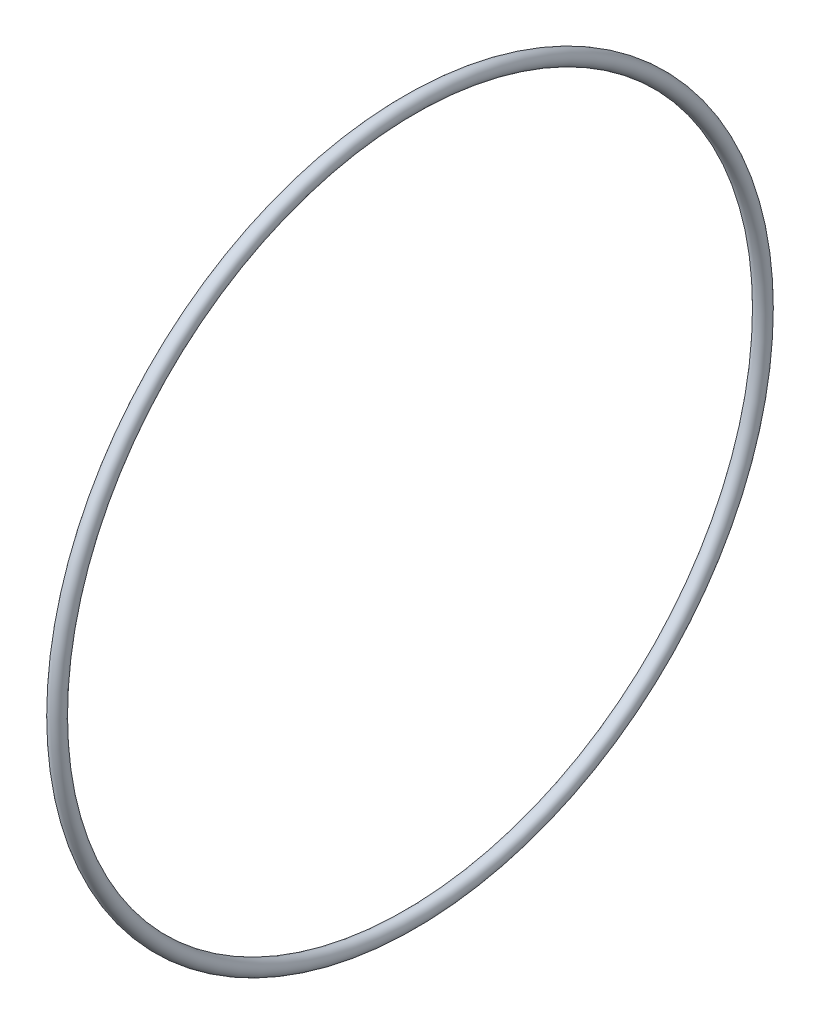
SolidWorks part; units mm, degrees
ref_plane "Plan de face" through (0, 0, 0) normal (0, 0, 1) x (1, 0, 0)
ref_plane "Plan de dessus" through (0, 0, 0) normal (0, 1, 0) x (1, 0, 0)
ref_plane "Plan de droite" through (0, 0, 0) normal (1, 0, 0) x (0, 0, -1)
sketch "Esquisse1" plane through (0, 0, 0) normal (0, 0, 1) x (1, 0, 0)
  line L0 (0, 0) -> (-49.5434, 0) construction
  circle A0 centre (0, 16.75) radius 0.35
  dimension "D1" = 0.7
  dimension "D2" = 33.5
revolve "Révolution1" add sketch "Esquisse1" angle 360 about L0
